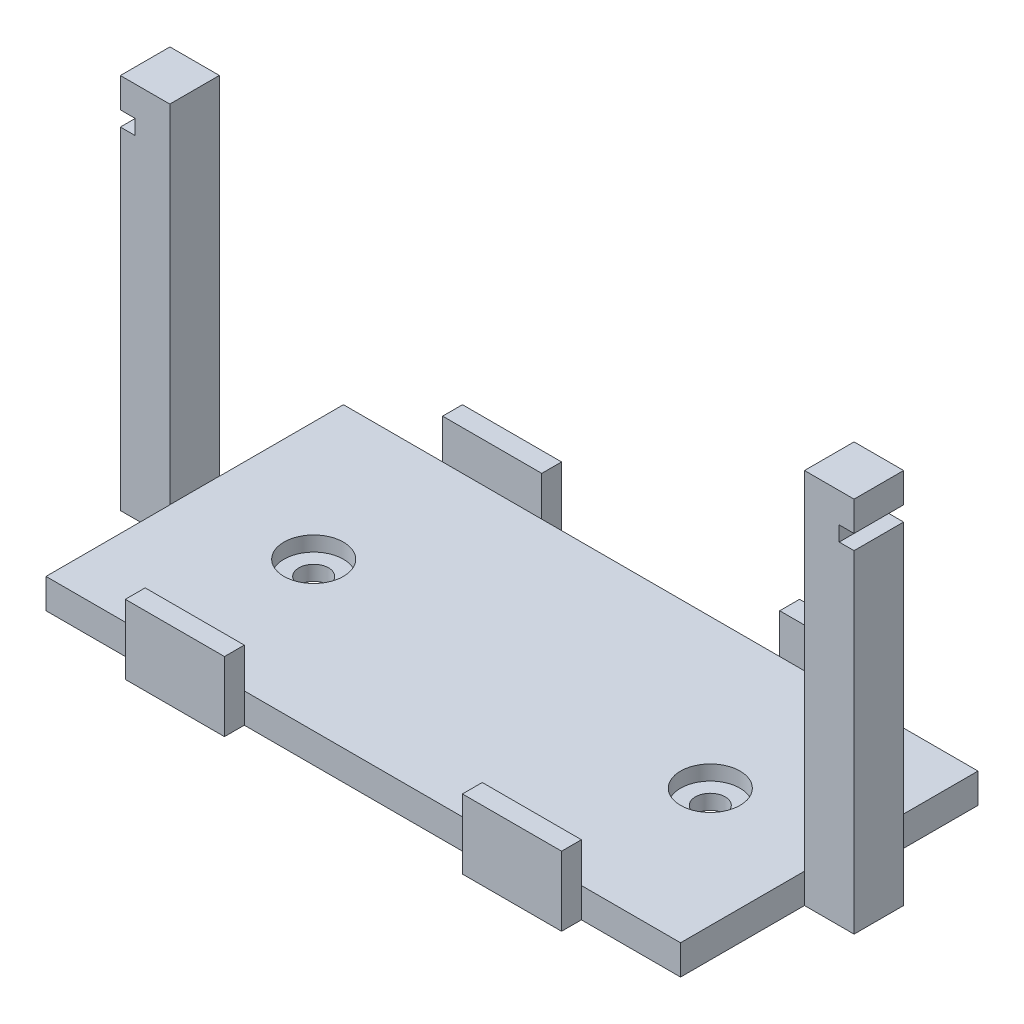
SolidWorks part; units mm, degrees
ref_plane "Plano frontal" through (0, 0, 0) normal (0, 0, 1) x (1, 0, 0)
ref_plane "Plano superior" through (0, 0, 0) normal (0, 1, 0) x (1, 0, 0)
ref_plane "Plano direito" through (0, 0, 0) normal (1, 0, 0) x (0, 0, -1)
sketch "Esboço1" plane through (0, 0, 0) normal (0, 1, 0) x (1, 0, 0)
  line L0 (-3.5206, -1.0619) -> (-0.5206, -1.0619) construction
  line L1 (-14.0206, 13.9381) -> (-4.0206, 13.9381)
  line L2 (-14.0206, 13.9381) -> (-14.0206, 1.4381)
  line L3 (-14.0206, -16.0619) -> (-4.0206, -16.0619)
  line L4 (49.9794, 13.9381) -> (49.9794, 1.4381)
  line L5 (39.9794, 13.9381) -> (49.9794, 13.9381)
  line L6 (36.4794, -1.0619) -> (39.4794, -1.0619) construction
  line L7 (5.9794, 15.9381) -> (-4.0206, 15.9381)
  line L8 (5.9794, 15.9381) -> (5.9794, 13.9381)
  line L10 (-4.0206, 15.9381) -> (-4.0206, 13.9381)
  line L11 (39.9794, 15.9381) -> (29.9794, 15.9381)
  line L12 (39.9794, 15.9381) -> (39.9794, 13.9381)
  line L13 (49.9794, -3.5619) -> (49.9794, -16.0619)
  line L14 (29.9794, 15.9381) -> (29.9794, 13.9381)
  line L15 (-14.0206, -3.5619) -> (-14.0206, -16.0619)
  line L16 (-4.0206, -16.0619) -> (-4.0206, -18.0619)
  line L17 (-4.0206, -18.0619) -> (5.9794, -18.0619)
  line L18 (5.9794, -16.0619) -> (5.9794, -18.0619)
  line L19 (5.9794, -16.0619) -> (29.9794, -16.0619)
  line L20 (29.9794, -16.0619) -> (29.9794, -18.0619)
  line L21 (29.9794, -18.0619) -> (39.9794, -18.0619)
  line L22 (39.9794, -16.0619) -> (39.9794, -18.0619)
  line L23 (54.9794, -3.5619) -> (49.9794, -3.5619)
  line L24 (54.9794, -3.5619) -> (54.9794, 1.4381)
  line L25 (54.9794, 1.4381) -> (49.9794, 1.4381)
  line L26 (39.9794, -16.0619) -> (49.9794, -16.0619)
  line L27 (-14.0206, 1.4381) -> (-19.0206, 1.4381)
  line L28 (5.9794, 13.9381) -> (29.9794, 13.9381)
  line L29 (-14.0206, -3.5619) -> (-19.0206, -3.5619)
  line L30 (-19.0206, 1.4381) -> (-19.0206, -3.5619)
  circle A0 centre (-2.0206, -1.0619) radius 1.5
  circle A1 centre (37.9794, -1.0619) radius 1.5
  point P8 (17.9794, -1.0619)
  point P9 (37.9794, -1.0619)
  point P10 (-2.0206, -1.0619)
  point P15 (0.9794, 13.9381)
  point P16 (34.9794, 13.9381)
  point P17 (0.9794, -16.0619)
  point P18 (34.9794, -16.0619)
  point P19 (5.9794, 13.9381)
  point P20 (-4.0206, 13.9381)
  point P21 (39.9794, 13.9381)
  point P22 (29.9794, 13.9381)
  point P23 (39.9794, 15.9381)
  point P24 (5.9794, 15.9381)
  point P33 (39.9794, -16.0619)
  point P34 (29.9794, -16.0619)
  point P35 (5.9794, -16.0619)
  point P36 (-4.0206, -16.0619)
  point P37 (-4.0206, -18.0619)
  point P38 (29.9794, -18.0619)
  point P47 (-14.0206, 1.4381)
  point P48 (-14.0206, -3.5619)
  point P49 (49.9794, -3.5619)
  point P50 (49.9794, 1.4381)
  point P51 (54.9794, -3.5619)
  point P56 (-19.0206, -3.5619)
  dimension "D5" = 3
  dimension "D6" = 3
  dimension "D1" = 64
  dimension "D2" = 30
  dimension "D3" = 20
  dimension "D4" = 20
  dimension "D7" = 15
  dimension "D8" = 15
  dimension "D9" = 5
  dimension "D10" = 5
  dimension "D11" = 5
  dimension "D12" = 5
  dimension "D13" = 2
  dimension "D14" = 2
  dimension "D17" = 5
  dimension "D18" = 5
extrude "Ressalto-extrusão1" add sketch "Esboço1" along normal blind 3
sketch "Esboço2" plane through (0, 3, 0) normal (0, 1, 0) x (1, 0, 0)
  line L1 (-4.0206, 13.9381) -> (5.9794, 13.9381)
  line L2 (-4.0206, 13.9381) -> (-4.0206, 15.9381)
  line L3 (-4.0206, 15.9381) -> (5.9794, 15.9381)
  line L4 (5.9794, 13.9381) -> (5.9794, 15.9381)
  line L5 (29.9794, 13.9381) -> (39.9794, 13.9381)
  line L6 (29.9794, 13.9381) -> (29.9794, 15.9381)
  line L7 (29.9794, 15.9381) -> (39.9794, 15.9381)
  line L8 (39.9794, 13.9381) -> (39.9794, 15.9381)
  line L9 (-4.0206, -18.0619) -> (5.9794, -18.0619)
  line L10 (-4.0206, -18.0619) -> (-4.0206, -16.0619)
  line L11 (-4.0206, -16.0619) -> (5.9794, -16.0619)
  line L12 (5.9794, -18.0619) -> (5.9794, -16.0619)
  line L13 (29.9794, -18.0619) -> (39.9794, -18.0619)
  line L14 (29.9794, -18.0619) -> (29.9794, -16.0619)
  line L15 (29.9794, -16.0619) -> (39.9794, -16.0619)
  line L16 (39.9794, -18.0619) -> (39.9794, -16.0619)
extrude "Ressalto-extrusão2" add sketch "Esboço2" along normal blind 4
sketch "Esboço3" plane through (0, 3, 0) normal (0, 1, 0) x (1, 0, 0)
  line L0 (-14.0206, 1.4381) -> (-19.0206, 1.4381) construction
  line L1 (-19.0206, -3.5619) -> (-14.0344, -3.5619)
  line L2 (-19.0206, -3.5619) -> (-19.0206, 1.4381)
  line L3 (-19.0206, 1.4381) -> (-14.0344, 1.4381)
  line L4 (-14.0344, -3.5619) -> (-14.0344, 1.4381)
  line L6 (49.9794, -3.5619) -> (54.9794, -3.5619)
  line L7 (49.9794, -3.5619) -> (49.9794, 1.4381)
  line L8 (49.9794, 1.4381) -> (54.9794, 1.4381)
  line L9 (54.9794, -3.5619) -> (54.9794, 1.4381)
extrude "Ressalto-extrusão3" add sketch "Esboço3" along normal blind 35
sketch "Esboço4" plane through (0, 3, 0) normal (0, 1, 0) x (1, 0, 0)
  circle A0 centre (-2.0206, -1.0619) radius 3
  circle A1 centre (37.9794, -1.0619) radius 3
  dimension "D1" = 6
  dimension "D2" = 6
extrude "Corte-extrusão1" cut sketch "Esboço4" against normal blind 1.5
sketch "Esboço5" plane through (54.9794, 0, 0) normal (1, 0, 0) x (0, 0, -1)
  line L0 (-3.5619, 38) -> (-3.5619, 0) construction
  line L1 (1.4381, 38) -> (1.4381, 0) construction
  line L2 (-3.5619, 35) -> (1.4381, 35)
  line L3 (-3.5619, 35) -> (-3.5619, 33.5)
  line L4 (-3.5619, 33.5) -> (1.4381, 33.5)
  line L5 (1.4381, 35) -> (1.4381, 33.5)
  point P0 (-3.5619, 35)
  point P1 (-3.5619, 33.5)
  dimension "D1" = 3
  dimension "D2" = 1.5
extrude "Corte-extrusão2" cut sketch "Esboço5" against normal blind 1.5
sketch "Esboço6" plane through (-19.0206, 0, 0) normal (-1, 0, 0) x (0, 0, 1)
  line L0 (-1.4381, 38) -> (-1.4381, 0) construction
  line L1 (3.5619, 38) -> (3.5619, 0) construction
  line L2 (-1.4381, 35) -> (3.5619, 35)
  line L3 (-1.4381, 35) -> (-1.4381, 33.5)
  line L4 (-1.4381, 33.5) -> (3.5619, 33.5)
  line L5 (3.5619, 35) -> (3.5619, 33.5)
  point P0 (-1.4381, 35)
  point P1 (-1.4381, 33.5)
  dimension "D1" = 3
  dimension "D2" = 1.5
extrude "Corte-extrusão3" cut sketch "Esboço6" against normal blind 1.5
